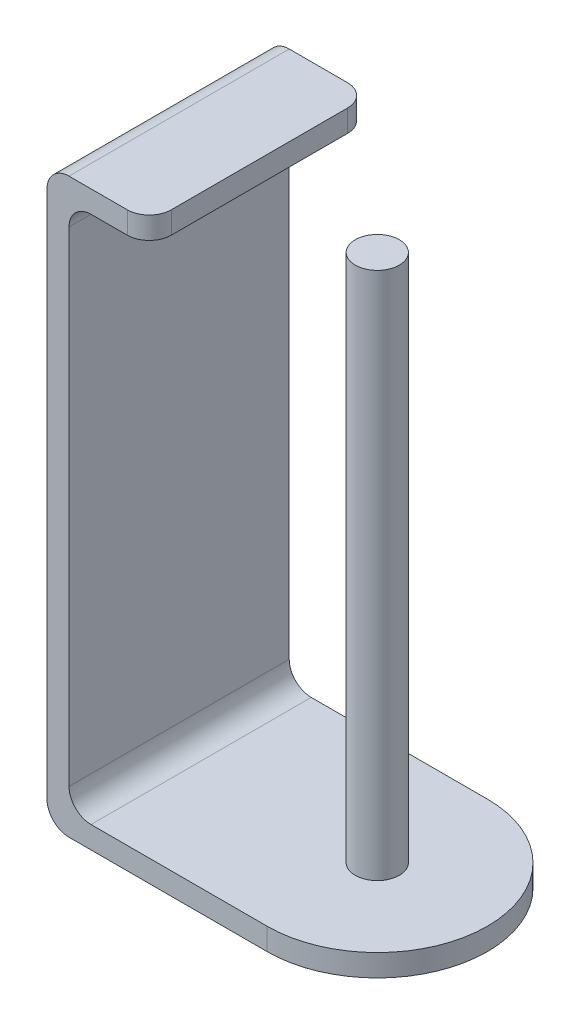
SolidWorks part; units mm, degrees
ref_plane "Front" through (0, 0, 0) normal (0, 0, 1) x (1, 0, 0)
ref_plane "Top" through (0, 0, 0) normal (0, 1, 0) x (1, 0, 0)
ref_plane "Right" through (0, 0, 0) normal (1, 0, 0) x (0, 0, -1)
sketch "Sketch2" plane through (0, 0, 0) normal (0, 1, 0) x (1, 0, 0)
  line L0 (0, 63.5) -> (0, -63.5)
  line L1 (0, -63.5) -> (127, -63.5)
  line L2 (127, 63.5) -> (0, 63.5)
  arc A0 (127, -63.5) -> (127, 63.5) centre (127, 0) ccw
  dimension "D2" = 190.5
  dimension "D1" = 127
extrude "Extrude1" add sketch "Sketch2" along normal blind 12.7
sketch "Sketch3" plane through (0, 12.7, 0) normal (0, 1, 0) x (-1, 0, 0)
  line L0 (0, 63.5) -> (-127, 63.5) construction
  line L1 (0, -63.5) -> (-12.7, -63.5)
  line L2 (0, -63.5) -> (0, 63.5)
  line L3 (0, 63.5) -> (-12.7, 63.5)
  line L4 (-12.7, -63.5) -> (-12.7, 63.5)
  dimension "D1" = 12.7
extrude "Extrude2" add sketch "Sketch3" along normal blind 304.8
sketch "Sketch4" plane through (0, 317.5, 0) normal (0, 1, 0) x (-1, 0, 0)
  line L0 (0, -63.5) -> (0, 63.5) construction
  line L1 (0, -63.5) -> (0, 63.5)
  line L2 (-58.9942, 63.5) -> (-58.9942, -63.5)
  line L3 (-12.7, -63.5) -> (-12.7, 63.5)
  line L4 (-12.7, 63.5) -> (-127, 63.5)
  line L5 (-127, -63.5) -> (-12.7, -63.5)
  line L7 (0, 63.5) -> (-58.9942, 63.5)
  line L8 (-58.9942, -63.5) -> (0, -63.5)
  arc A1 (-127, 63.5) -> (-127, -63.5) centre (-127, 0) ccw
  dimension "D1" = 0
extrude "Extrude3" add sketch "Sketch4" along normal blind 12.7
fillet "Fillet3" radius 12.7
fillet "Fillet1" radius 12.7
fillet "Fillet2" radius 12.7
sketch "Sketch5" plane through (0, 12.7, 0) normal (0, 1, 0) x (-1, 0, 0)
  circle A0 centre (-127, 0) radius 12.7
  dimension "D1" = 25.4
extrude "Extrude4" add sketch "Sketch5" along normal up to surface
